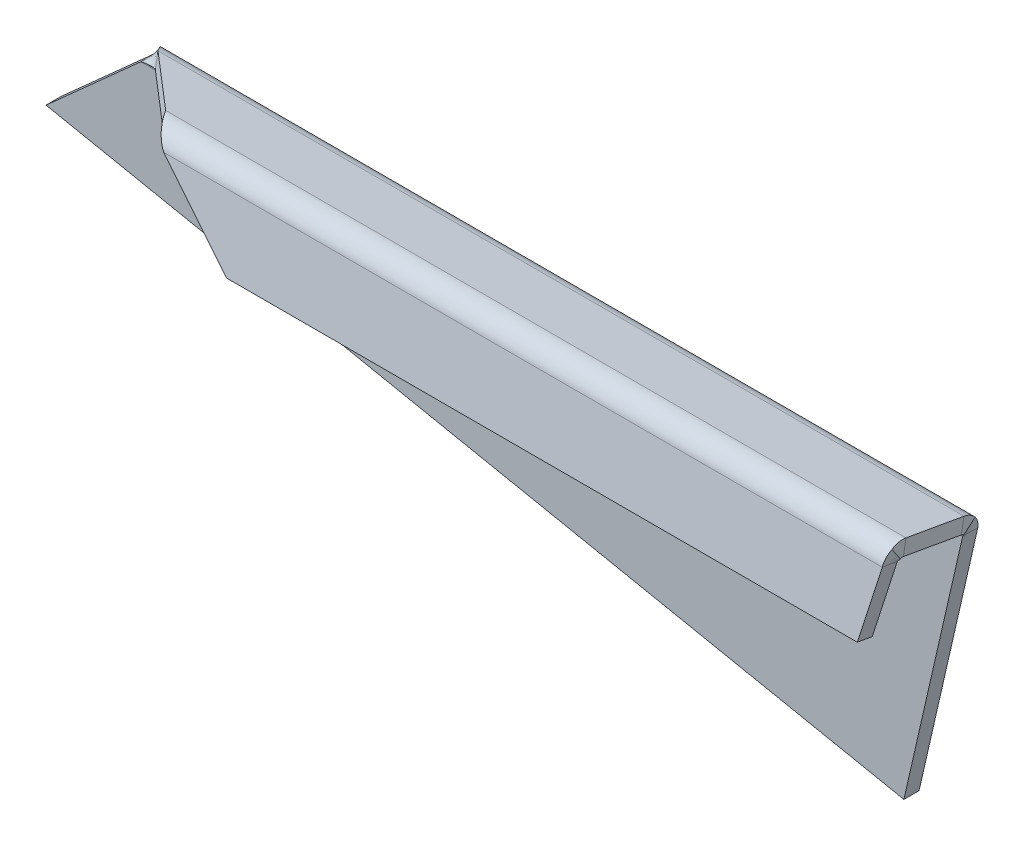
SolidWorks part; units mm, degrees
ref_plane "前视基准面" through (0, 0, 0) normal (0, 0, 1) x (1, 0, 0)
ref_plane "上视基准面" through (0, 0, 0) normal (0, 1, 0) x (1, 0, 0)
ref_plane "右视基准面" through (0, 0, 0) normal (1, 0, 0) x (0, 0, -1)
sketch "草图1" plane through (0, 0, 0) normal (0, 0, 1) x (1, 0, 0)
  line L0 (0, 40) -> (-8, 80)
  line L3 (-341, 80) -> (-8, 80)
  line L4 (0, 0) -> (0, 40)
  line L5 (-485, -49) -> (-32, -140)
  line L7 (0, 0) -> (-32, -140)
  line L8 (-485, -49) -> (-341, 80)
  point P7 (0, 80)
  dimension "D1" = 485
  dimension "D4" = 80
  dimension "D5" = 341
  dimension "D2" = 140
  dimension "D3" = 40
  dimension "D6" = 8
  dimension "D7" = 32
  dimension "D8" = 91
sheet metal parameters "钣金1" thickness 8 parameters "D1"=2
base flange "基体-法兰1" sketch "草图1" thickness 8 reverse thickness direction yes parameters "D1"=2
sketch "草图3" plane through (0, 0, 0) normal (0, 0, -1) x (-1, 0, 0)
  line L2 (8, 0) -> (341, 0)
  line L3 (8, 0) -> (341, 0)
  dimension "D1" = 80
sketched bend "绘制的折弯1" parameters "D1"=2
bend "草图折弯1" bend radius 2 bend angle 80 parameters "D5"=1
sketch "草图4" plane through (0, 4.0755, -0.7186) normal (0, 0.9848, -0.1736) x (1, 0, 0)
  line L2 (-8, -44.9319) -> (-341, -44.9319)
  line L3 (-8, -44.9319) -> (-341, -44.9319)
  dimension "D1" = 40
sketched bend "绘制的折弯2" parameters "D1"=2
bend "草图折弯2" bend radius 2 bend angle 90 parameters "D5"=2
flat pattern "平板型式1"
sketch "折弯-线1" plane through (0, 0, 0) normal (0, 1, 0) x (-1, 0, 0)
bend of the flat pattern "展开-<草图折弯1>1"
bend of the flat pattern "展开-<草图折弯2>1"
